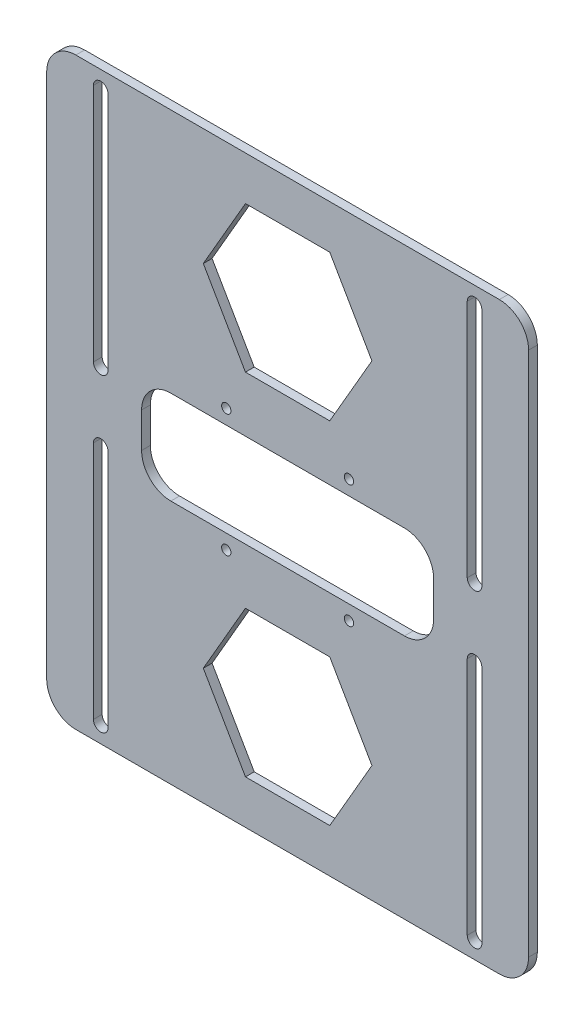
SolidWorks part; units mm, degrees
ref_plane "前视基准面" through (0, 0, 0) normal (0, 0, 1) x (1, 0, 0)
ref_plane "上视基准面" through (0, 0, 0) normal (0, 1, 0) x (1, 0, 0)
ref_plane "右视基准面" through (0, 0, 0) normal (1, 0, 0) x (0, 0, -1)
sketch "草图1" plane through (0, 0, 0) normal (0, 0, 1) x (1, 0, 0)
  line L1 (-82.5, 100) -> (82.5, 100)
  line L2 (-82.5, 100) -> (-82.5, -100)
  line L3 (-82.5, -100) -> (82.5, -100)
  line L4 (82.5, 100) -> (82.5, -100)
  line L5 (-82.5, 100) -> (82.5, -100) construction
  line L6 (-82.5, -100) -> (82.5, 100) construction
  point P0 (0, 0)
  dimension "D1" = 200
  dimension "D2" = 165
extrude "凸台-拉伸1" add sketch "草图1" along normal blind 3
hole_wizard "Ø3.2 (3.2) 直径孔1" positions "草图2" profile "草图3" hole size "Ø3.2" standard "GB"
sketch "草图2" plane through (0, 0, 3) normal (0, 0, 1) x (1, 0, 0)
  point P0 (-21, 21)
  point P2 (-21, -21)
  point P4 (21, 21)
  point P6 (21, -21)
  dimension "D1" = 42
  dimension "D2" = 42
  dimension "D3" = 42
  dimension "D4" = 42
  dimension "D5" = 21
  dimension "D6" = 21
  dimension "D7" = 21
  dimension "D8" = 21
sketch "草图3" plane through (-21, 21, 3) normal (1, 0, 0) x (0, -1, 0)
  line L0 (0, 0) -> (0, 3)
  line L1 (0, 3) -> (1.6, 3)
  line L2 (1.6, 3) -> (1.6, 0)
  line L5 (1.6, 0) -> (0, 0)
  line L11 (0, -6.35) -> (0, 107.95) construction
  dimension "通孔孔直径" = 3.2
  dimension "通孔孔深度" = 3
sketch "草图4" plane through (0, 0, 3) normal (0, 0, 1) x (1, 0, 0)
  line L0 (-64, 94) -> (-64, 12) construction
  line L1 (-61.5, 94) -> (-61.5, 12)
  line L2 (-66.5, 94) -> (-66.5, 12)
  line L3 (64, 94) -> (64, 12) construction
  line L4 (66.5, 94) -> (66.5, 12)
  line L5 (61.5, 94) -> (61.5, 12)
  line L6 (-82.5, 100) -> (-82.5, -100) construction
  line L7 (82.5, 100) -> (-82.5, 100) construction
  arc A0 (-61.5, 94) -> (-66.5, 94) centre (-64, 94) ccw
  arc A1 (-66.5, 12) -> (-61.5, 12) centre (-64, 12) ccw
  arc A2 (66.5, 94) -> (61.5, 94) centre (64, 94) ccw
  arc A3 (61.5, 12) -> (66.5, 12) centre (64, 12) ccw
  point P2 (-64, 53)
  point P7 (64, 53)
  dimension "D2" = 2.5
  dimension "D3" = 2.5
  dimension "D8" = 12
  dimension "D1" = 128
  dimension "D4" = 18.5
  dimension "D5" = 12
  dimension "D6" = 6
  dimension "D7" = 6
sketch "草图5" plane through (0, 0, 3) normal (0, 0, 1) x (1, 0, 0)
  line L1 (-50, -16) -> (50, -16)
  line L2 (-50, -16) -> (-50, 16)
  line L3 (-50, 16) -> (50, 16)
  line L4 (50, -16) -> (50, 16)
  line L5 (-50, -16) -> (50, 16) construction
  line L6 (-50, 16) -> (50, -16) construction
  point P0 (0, 0)
  dimension "D1" = 32
  dimension "D2" = 100
extrude "切除-拉伸3" cut sketch "草图5" against normal blind 3
fillet "圆角2" radius 10 4 edges at (50, -16, 1.5) (-50, -16, 1.5) (50, 16, 1.5) (-50, 16, 1.5)
extrude "切除-拉伸4" cut sketch "草图4" against normal blind 10
fillet "圆角3" radius 10 4 edges at (82.5, -100, 1.5) (-82.5, -100, 1.5) (82.5, 100, 1.5) (-82.5, 100, 1.5)
mirror "镜向1" about plane through (0, 0, 0) normal (0, 1, 0) of "切除-拉伸4"
sketch "草图7" plane through (0, 0, 3) normal (0, 0, 1) x (1, 0, 0)
  line L1 (28.8675, 59.994) -> (14.439, 84.997)
  line L2 (14.439, 84.997) -> (-14.4285, 85.003)
  line L3 (-14.4285, 85.003) -> (-28.8675, 60.006)
  line L4 (-28.8675, 60.006) -> (-14.439, 35.003)
  line L5 (-14.439, 35.003) -> (14.4285, 34.997)
  line L6 (14.4285, 34.997) -> (28.8675, 59.994)
  line L7 (28.8675, -59.9953) -> (14.4297, -34.9977)
  line L8 (14.4297, -34.9977) -> (-14.4378, -35.0023)
  line L9 (-14.4378, -35.0023) -> (-28.8675, -60.0047)
  line L10 (-28.8675, -60.0047) -> (-14.4297, -85.0023)
  line L11 (-14.4297, -85.0023) -> (14.4378, -84.9977)
  line L12 (14.4378, -84.9977) -> (28.8675, -59.9953)
  circle A0 centre (0, 60) radius 25 construction
  circle A1 centre (0, -60) radius 25 construction
  dimension "D1" = 50
  dimension "D2" = 50
  dimension "D3" = 60
  dimension "D4" = 60
extrude "切除-拉伸5" cut sketch "草图7" against normal blind 10
